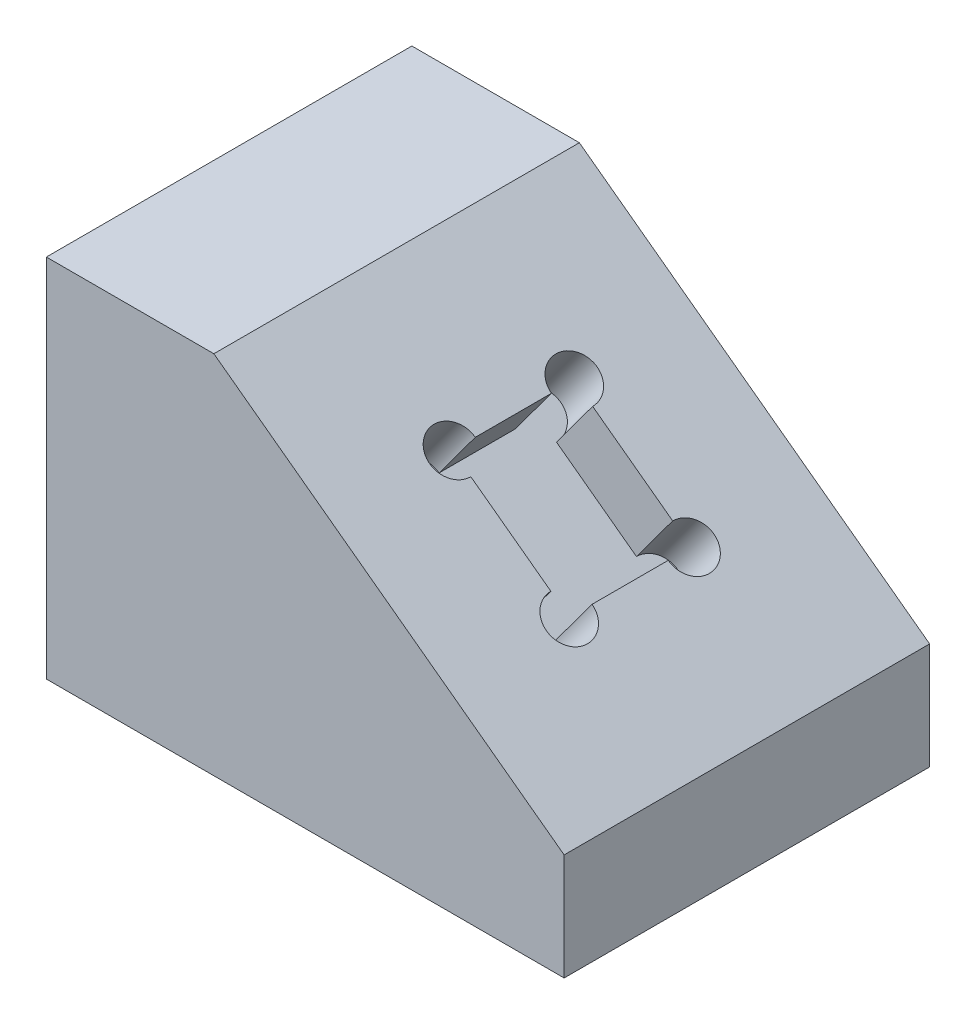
SolidWorks part; units mm, degrees
ref_plane "Front" through (0, 0, 0) normal (0, 0, 1) x (1, 0, 0)
ref_plane "Top" through (0, 0, 0) normal (0, 1, 0) x (1, 0, 0)
ref_plane "Right" through (0, 0, 0) normal (1, 0, 0) x (0, 0, -1)
sketch "Sketch1" plane through (0, 0, 0) normal (0, 0, 1) x (1, 0, 0)
  line L0 (34.925, 76.2) -> (107.95, 22.225)
  line L1 (0, 0) -> (107.95, 0)
  line L2 (0, 0) -> (0, 76.2)
  line L3 (0, 76.2) -> (34.925, 76.2)
  line L4 (107.95, 0) -> (107.95, 22.225)
  dimension "D1" = 76.2
  dimension "D2" = 107.95
  dimension "D3" = 22.225
  dimension "D4" = 34.925
extrude "Base-Extrude" add sketch "Sketch1" against normal blind 76.2
sketch "Sketch2" plane through (48.7623, 65.9725, 0) normal (0.5944, 0.8042, 0) x (-0.8042, 0.5944, 0)
  line L0 (-73.6005, -76.2) -> (17.2067, 0) construction
  line L1 (-73.6005, -38.1) -> (-43.3314, -38.1) construction
  line L2 (-73.6005, 0) -> (17.2067, 0) construction
  line L3 (17.2067, -76.2) -> (17.2067, 0) construction
  line L4 (-73.6005, -76.2) -> (-73.6005, 0) construction
  line L5 (-38.5689, -50.8) -> (-17.8248, -50.8)
  line L6 (-43.3314, -46.0375) -> (-43.3314, -30.1625)
  line L7 (-38.5689, -25.4) -> (-17.8248, -25.4)
  line L8 (-13.0623, -46.0375) -> (-13.0623, -30.1625)
  arc A0 (-13.0623, -30.1625) -> (-17.8248, -25.4) centre (-13.0623, -25.4) ccw
  arc A1 (-17.8248, -50.8) -> (-13.0623, -46.0375) centre (-13.0623, -50.8) ccw
  arc A2 (-43.3314, -46.0375) -> (-38.5689, -50.8) centre (-43.3314, -50.8) ccw
  arc A3 (-38.5689, -25.4) -> (-43.3314, -30.1625) centre (-43.3314, -25.4) ccw
  dimension "D2" = 9.525
  dimension "D1" = 25.4
extrude "Cut-Extrude1" cut sketch "Sketch2" against normal blind 12.7
